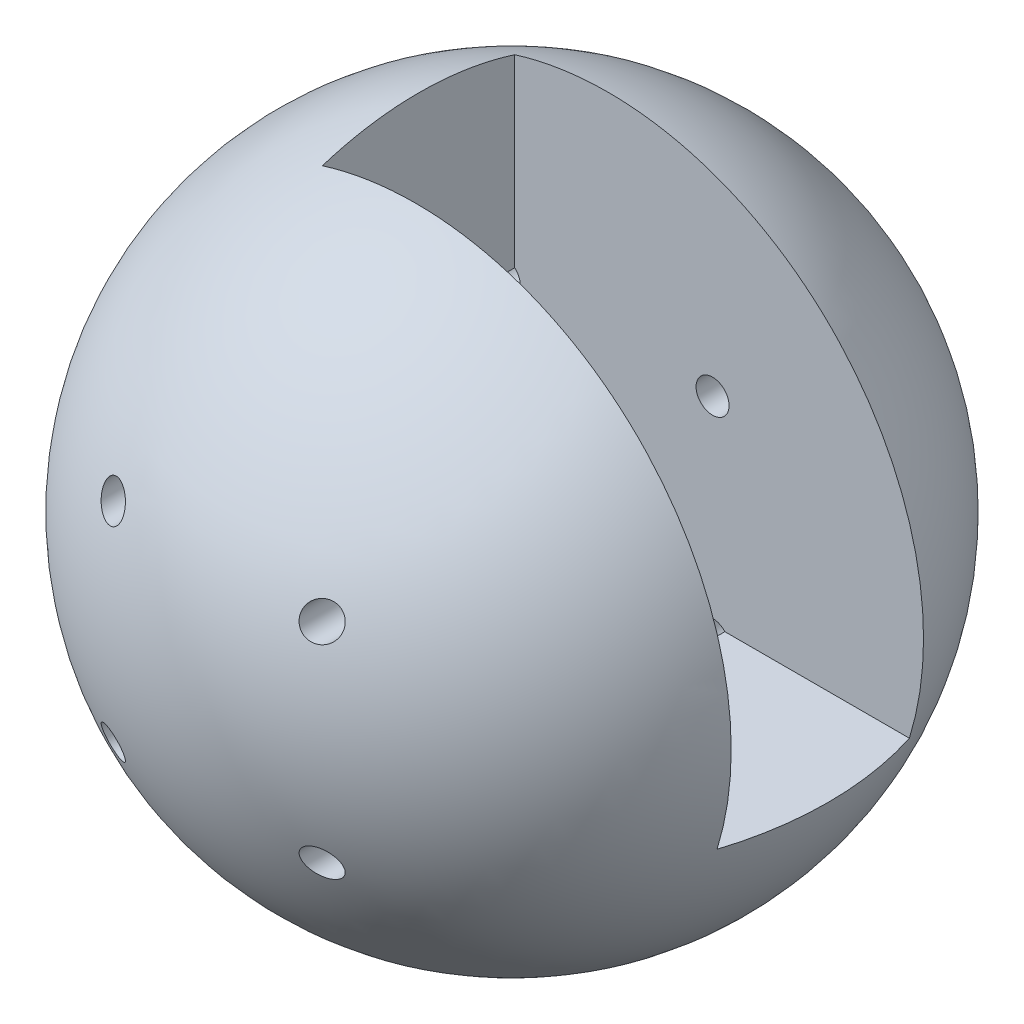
SolidWorks part; units mm, degrees
ref_plane "Plan de face" through (0, 0, 0) normal (0, 0, 1) x (1, 0, 0)
ref_plane "Plan de dessus" through (0, 0, 0) normal (0, 1, 0) x (1, 0, 0)
ref_plane "Plan de droite" through (0, 0, 0) normal (1, 0, 0) x (0, 0, -1)
sketch "Esquisse1" plane through (0, 0, 0) normal (0, 0, 1) x (1, 0, 0)
  line L0 (0, 0) -> (0, 82.9299) construction
  line L1 (0, 60) -> (0, -60)
  arc A0 (0, 60) -> (0, -60) centre (0, 0) ccw
  dimension "D1" = 60
revolve "Révolution1" add sketch "Esquisse1" angle 360 about L0
sketch "Esquisse2" plane through (0, 0, 0) normal (0, 0, 1) x (1, 0, 0)
  line L1 (-17, -17) -> (102.4959, -17)
  line L2 (-17, -17) -> (-17, 89.5133)
  line L3 (-17, 89.5133) -> (102.4959, 89.5133)
  line L4 (102.4959, -17) -> (102.4959, 89.5133)
  point P5 (0, 0)
  point P6 (-23.595, -20.2057)
  dimension "D1" = 17
  dimension "D2" = 17
extrude "Enlèv. mat.-Extru.1" cut sketch "Esquisse2" against normal mid plane 35
sketch "Esquisse3" plane through (0, 0, 0) normal (0, 0, 1) x (1, 0, 0)
  line L0 (-15.4693, 0) -> (0, 0) construction
  line L1 (0, 0) -> (0, 15.1217) construction
  line L2 (-17, 54.8156) -> (-17, 57.5413) construction
  line L3 (57.5413, -17) -> (54.8156, -17) construction
  circle A0 centre (-19, 19) radius 3
  circle A1 centre (19, 19) radius 3
  circle A2 centre (19, -19) radius 3
  circle A3 centre (-19, -19) radius 3
  dimension "D3" = 6
  dimension "D4" = 38
  dimension "D6" = 36
  dimension "D7" = 36
  dimension "D1" = 2
  dimension "D2" = 2
extrude "Enlèv. mat.-Extru.2" cut sketch "Esquisse3" against normal through all both and the other way through all
